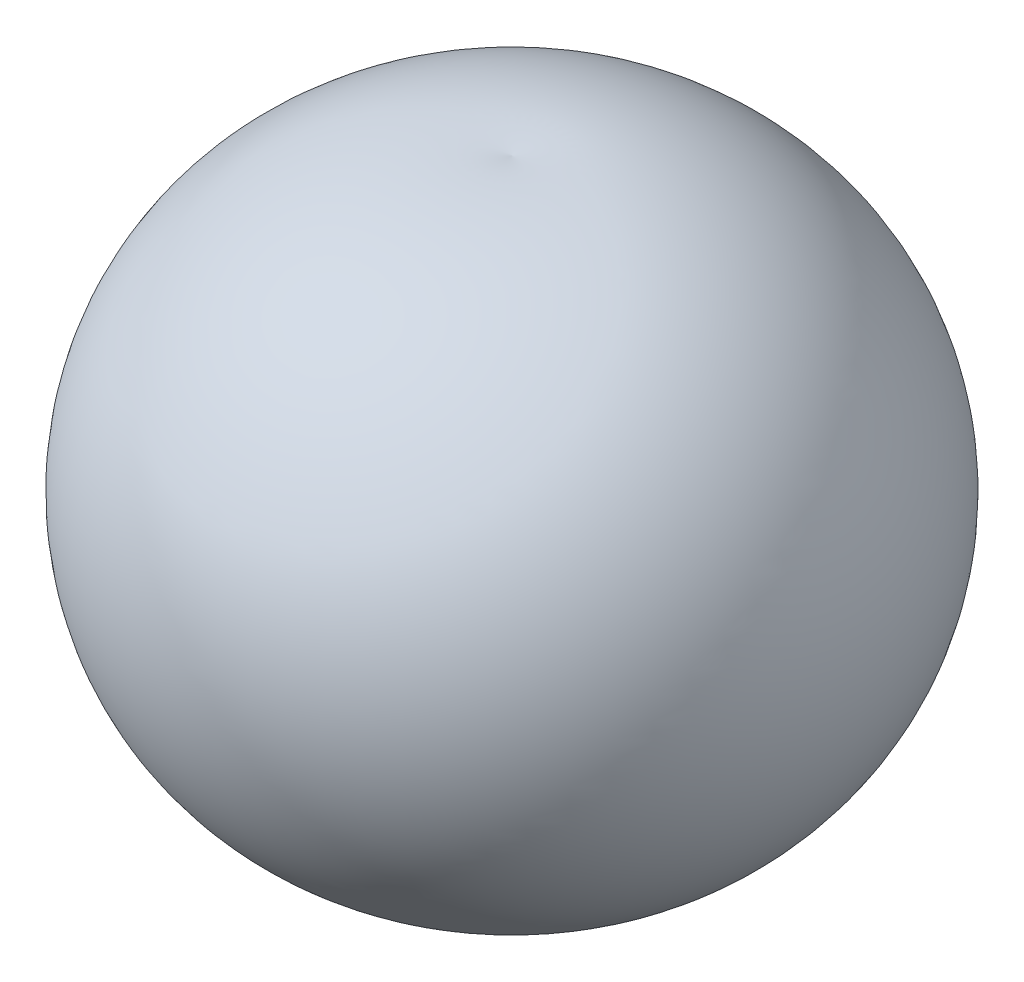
SolidWorks part; units mm, degrees
ref_plane "前视基准面" through (0, 0, 0) normal (0, 0, 1) x (1, 0, 0)
ref_plane "上视基准面" through (0, 0, 0) normal (0, 1, 0) x (1, 0, 0)
ref_plane "右视基准面" through (0, 0, 0) normal (1, 0, 0) x (0, 0, -1)
sketch "草图1" plane through (0, 0, 0) normal (1, 0, 0) x (0, 0, -1)
  line L0 (-250, 657) -> (-250, 1517) construction
  line L1 (-250, 657) -> (243.2757, 1361.4708) construction
  line L2 (-250, 657) -> (-743.2757, -47.4708) construction
  line L3 (-250, 1517) -> (-53.1695, 1552.465) construction
  line L4 (-53.1695, 1552.465) -> (-250, 2644.8741) construction
  line L5 (-250, 2644.8741) -> (-250, 1517) construction
  line L6 (0, 2948.3754) -> (0, -1276.6246) construction
  line L7 (0, 2629.0911) -> (0, 1646.5596)
  line L8 (0, 460.2041) -> (0, -895.7874)
  arc A0 (0, 2629.0911) -> (-1390.1977, -971.3711) centre (-250, 657) ccw
  arc A2 (-1390.1977, -971.3711) -> (0, -895.7874) centre (-743.2757, -47.4708) ccw
  arc A3 (0, 460.2041) -> (-554.2517, 563.9433) centre (-250, 657) cw
  arc A4 (0, 1646.5596) -> (-880.3065, 1459.7715) centre (-250, 657) ccw
  arc A5 (-880.3065, 1459.7715) -> (-554.2517, 563.9433) centre (243.2757, 1361.4708) ccw
  point P0 (-250, 657)
  dimension "D4" = 200
  dimension "D1" = 250
  dimension "D2" = 657
  dimension "D3" = 860
  dimension "D6" = 145
  dimension "D7" = 860
  dimension "D8" = 860
  dimension "D11" = 1110
revolve "旋转1" add sketch "草图1" angle 360 about L6
